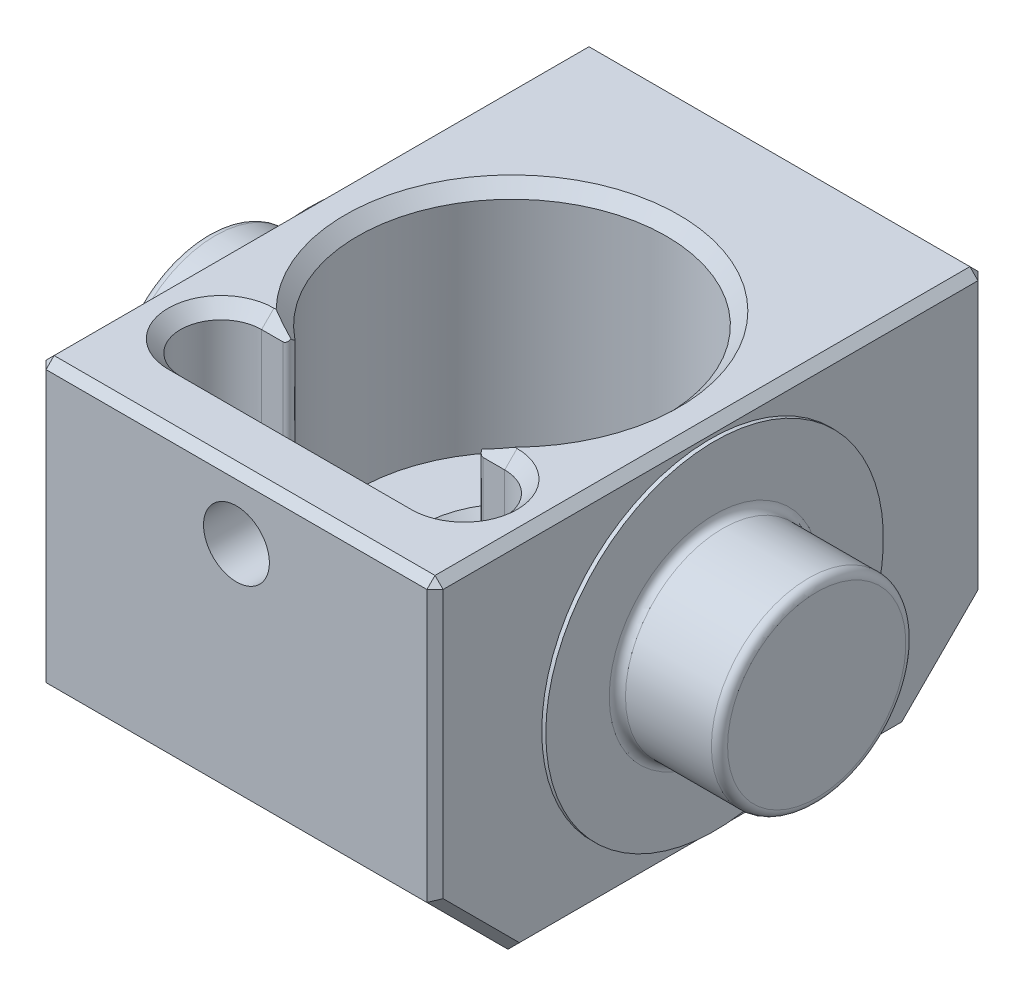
SolidWorks part; units mm, degrees
ref_plane "Front Plane" through (0, 0, 0) normal (0, 0, 1) x (1, 0, 0)
ref_plane "Top Plane" through (0, 0, 0) normal (0, 1, 0) x (1, 0, 0)
ref_plane "Right Plane" through (0, 0, 0) normal (1, 0, 0) x (0, 0, -1)
sketch "Sketch1" plane through (0, 0, 0) normal (1, 0, 0) x (0, 0, -1)
  line L1 (-17, 11.1125) -> (17, 11.1125)
  line L2 (-17, 11.1125) -> (-17, -11.1125)
  line L3 (-17, -11.1125) -> (17, -11.1125)
  line L4 (17, 11.1125) -> (17, -11.1125)
  line L5 (-17, 11.1125) -> (17, -11.1125) construction
  line L6 (-17, -11.1125) -> (17, 11.1125) construction
  point P0 (0, 0)
  dimension "D1" = 22.225
  dimension "D2" = 34
extrude "Boss-Extrude1" add sketch "Sketch1" along normal mid plane 24.5
sketch "Sketch2" plane through (0, 0, 0) normal (0, 0, 1) x (1, 0, 0)
  line L0 (0, 0) -> (15.0375, 0) construction
  line L1 (12.25, 10.414) -> (12.5, 10.414)
  line L2 (12.25, 11.1125) -> (12.25, -11.1125) construction
  line L3 (12.5, 10.414) -> (12.5, 6)
  line L4 (12.5, 6) -> (18.8, 6)
  line L5 (18.8, 6) -> (18.8, 0)
  line L6 (18.8, 0) -> (12.25, 0)
  line L7 (12.25, 0) -> (12.25, 10.414)
  line L8 (0, 10.193) -> (0, -1.9896) construction
  dimension "D1" = 20.828
  dimension "D2" = 25
  dimension "D3" = 12
  dimension "D4" = 37.6
revolve "Revolve1" add sketch "Sketch2" angle 360 about L0
mirror "Mirror1" about plane through (0, 0, 0) normal (1, 0, 0) of "Revolve1"
sketch "Sketch3" plane through (0, 0, 0) normal (0, 0, 1) x (1, 0, 0)
  line L0 (0, 11.1125) -> (0, -3.175)
  line L1 (12.25, 11.1125) -> (-12.25, 11.1125) construction
  line L2 (0, -3.175) -> (-9.5288, -3.175)
  line L3 (-9.5288, -3.175) -> (-9.5288, 11.1125)
  line L4 (-9.5288, 11.1125) -> (0, 11.1125)
  line L5 (0, 10.1247) -> (0, -4.0859) construction
  dimension "D1" = 19.0576
  dimension "D2" = 3.175
revolve "Cut-Revolve1" cut sketch "Sketch3" angle 360 about L5
sketch "Sketch4" plane through (0, 0, 0) normal (0, 0, 1) x (1, 0, 0)
  line L0 (0, -11.1125) -> (0, -3.175)
  line L1 (12.25, -11.1125) -> (-12.25, -11.1125) construction
  line L2 (0, -11.1125) -> (-5.1562, -11.1125)
  line L3 (-5.1562, -11.1125) -> (-5.1562, -3.175)
  line L4 (9.5288, -3.175) -> (-9.5288, -3.175) construction
  line L5 (-5.1562, -3.175) -> (0, -3.175)
  line L6 (0, -1.9252) -> (0, -10.0139) construction
  dimension "D1" = 10.3124
revolve "Cut-Revolve2" cut sketch "Sketch4" angle 360 about L6
sketch "Sketch5" plane through (0, 11.1125, 0) normal (0, 1, 0) x (1, 0, 0)
  line L0 (-7.5, -10.4489) -> (7.5, -10.4489) construction
  line L1 (-7.5, -7.9489) -> (7.5, -7.9489)
  line L2 (-7.5, -12.9489) -> (7.5, -12.9489)
  line L3 (-1.1729, 0) -> (1.6976, 0) construction
  arc A0 (-7.5, -7.9489) -> (-7.5, -12.9489) centre (-7.5, -10.4489) ccw
  arc A1 (7.5, -12.9489) -> (7.5, -7.9489) centre (7.5, -10.4489) ccw
  circle A4 centre (0, 0) radius 9.5288 construction
  point P2 (0, -10.4489)
  dimension "D1" = 17.4777
  dimension "D2" = 7.9489
  dimension "D3" = 5
  dimension "D4" = 15
extrude "Cut-Extrude1" cut sketch "Sketch5" against normal blind 6.5
chamfer "Chamfer1" distance 5 angle 45 2 edges at (0, -11.1125, -17) (0, -11.1125, 17)
chamfer "Chamfer2" distance 0.5 angle 45 14 edges at (12.25, -8.6125, 14.5) (12.25, 2.5, 17) (12.25, -11.1125, 0) (12.25, -8.6125, -14.5) (12.25, 2.5, -17) (-12.25, 2.5, 17) (-12.25, -8.6125, 14.5) (-12.25, -11.1125, 0) (-12.25, -8.6125, -14.5) (-12.25, 2.5, -17) (0, 11.1125, -17) (12.25, 11.1125, 0) (0, 11.1125, 17) (-12.25, 11.1125, 0)
chamfer "Chamfer4" distance 0.762 angle 45 6 edges at (-6.3774, 11.1125, 7.9489) (-10, 11.1125, 10.4489) (0, 11.1125, 12.9489) (10, 11.1125, 10.4489) (6.3774, 11.1125, 7.9489) (0, 11.1125, -9.5288)
fillet "Fillet1" radius 0.3 2 edges at (5.2548, 7.4815, 7.9489) (-5.2548, 7.4815, 7.9489)
chamfer "Chamfer5" distance 0.5 angle 45 2 edges at (0, -3.175, 5.1562) (0, -11.1125, 5.1562)
fillet "Fillet2" radius 0.5 2 edges at (-18.8, 0, 6) (18.8, 0, 6)
fillet "Fillet3" radius 0.5 2 edges at (12.5, 0, 6) (-12.5, 0, 6)
sketch "Sketch9" plane through (0, 0, 17) normal (0, 0, 1) x (1, 0, 0)
  line L0 (0, 4.6125) -> (0, 11.1125) construction
  line L1 (-7.5, 4.6125) -> (7.5, 4.6125) construction
  line L2 (-11.75, 11.1125) -> (11.75, 11.1125) construction
  circle A0 centre (0, 7.1725) radius 2.032
  circle A1 centre (0, 7.1725) radius 3.3274 construction
  dimension "D1" = 4.064
  dimension "D2" = 6.6548
  dimension "D3" = 3.94
extrude "Cut-Extrude2" cut sketch "Sketch9" against normal up to next
